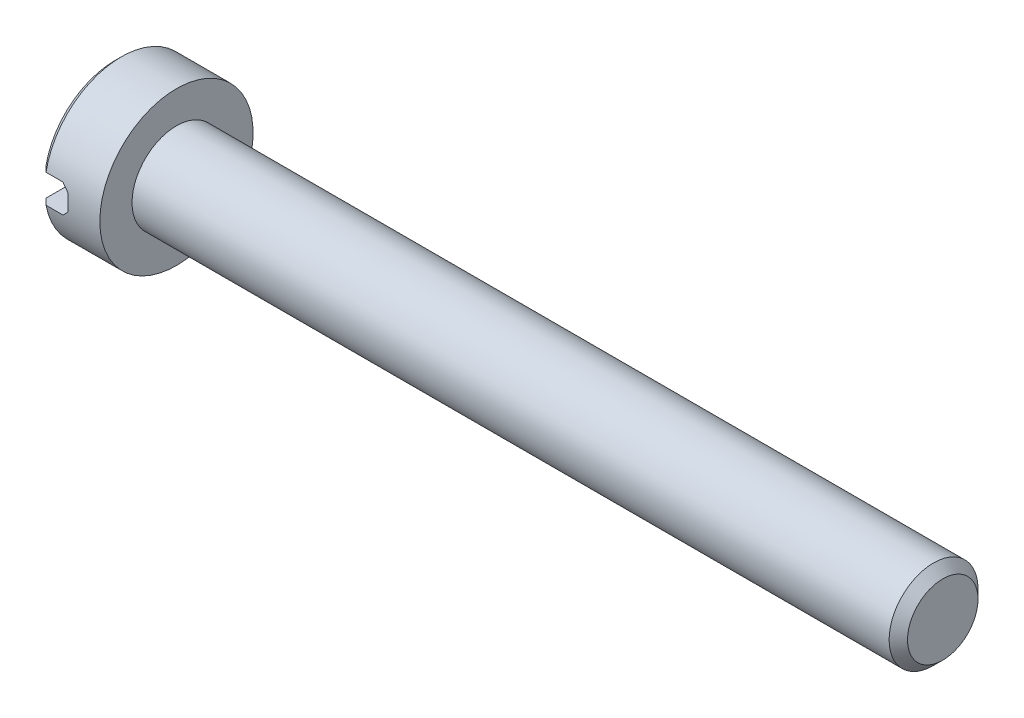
SolidWorks part; units mm, degrees
ref_plane "Face" through (0, 0, 0) normal (0, 0, 1) x (1, 0, 0)
ref_plane "Dessus" through (0, 0, 0) normal (0, 1, 0) x (1, 0, 0)
ref_plane "Droite" through (0, 0, 0) normal (1, 0, 0) x (0, 0, -1)
sketch "Esquisse1" plane through (0, 0, 0) normal (0, 0, 1) x (1, 0, 0)
  line L0 (0, 0) -> (0, 2.3)
  line L1 (0.2, 2.5) -> (2, 2.5)
  line L2 (2, 2.5) -> (2, 0)
  line L5 (0, 0) -> (7.6423, 0) construction
  line L7 (0, 2.3) -> (0.2, 2.5)
  line L8 (0, 0) -> (2, 0)
  point P1 (0, 2.5)
  dimension "D1" = 2.5
  dimension "D3" = 2
revolve "Révolution1" add sketch "Esquisse1" angle 360 about L5
sketch "Esquisse2" plane through (0, 0, 0) normal (0, 0, 1) x (1, 0, 0)
  line L0 (0, 2.3) -> (0, -2.3) construction
  line L1 (0, 0.4655) -> (0.7534, 0.4655)
  line L2 (0, 0.4655) -> (0, -0.4655)
  line L3 (0, -0.4655) -> (0.7534, -0.4655)
  line L4 (0.9534, 0.2655) -> (0.9534, -0.2655)
  line L5 (0.7534, 0.4655) -> (0.9534, 0.2655)
  line L6 (0.7534, -0.4655) -> (0.9534, -0.2655)
  point P1 (0.9534, -0.4655)
  point P3 (0.9534, 0.4655)
extrude "Enlèv. mat.-Extru.1" cut sketch "Esquisse2" against normal mid plane 10
sketch "Esquisse3" plane through (2, 0, 0) normal (1, 0, 0) x (0, 0, -1)
  circle A0 centre (0, 0) radius 1.45
extrude "Extrusion1" add sketch "Esquisse3" along normal blind 25
chamfer "Chanfrein1" distance 0.3 angle 45 1 edges at (27, 0, -1.45)
